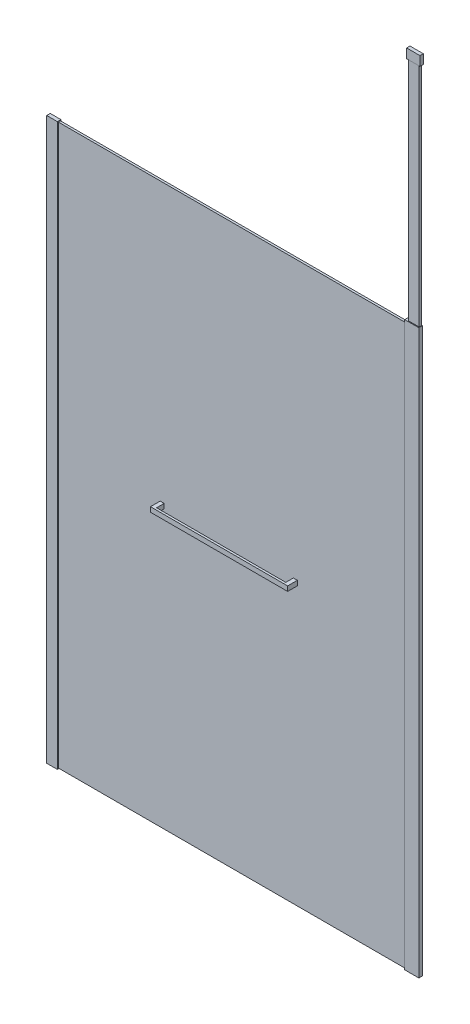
SolidWorks part; units mm, degrees
ref_plane "Płaszczyzna przednia" through (0, 0, 0) normal (0, 0, 1) x (1, 0, 0)
ref_plane "Płaszczyzna górna" through (0, 0, 0) normal (0, 1, 0) x (1, 0, 0)
ref_plane "Płaszczyzna prawa" through (0, 0, 0) normal (1, 0, 0) x (0, 0, -1)
sketch "Szkic1" plane through (0, 0, 0) normal (0, 1, 0) x (1, 0, 0)
  line L0 (0, 0) -> (0, 13.3)
  line L1 (0, 13.3) -> (40, 13.3)
  line L2 (40, 13.3) -> (40, 11.4)
  line L3 (40, 11.4) -> (6.5, 11.4)
  line L4 (6.5, 11.4) -> (6.5, 3.4)
  line L5 (6.5, 3.4) -> (40, 3.4)
  line L6 (40, 3.4) -> (40, 0)
  line L7 (40, 0) -> (0, 0)
  dimension "D1" = 40
  dimension "D2" = 13.3
  dimension "D3" = 33.5
  dimension "D4" = 1.9
  dimension "D5" = 8
extrude "Dodanie-wyciągnięcie1" add sketch "Szkic1" along normal blind 2100 from offset 3
sketch "Szkic2" plane through (0, 3, 0) normal (0, -1, 0) x (1, 0, 0)
  line L0 (6.5, -11.4) -> (40, -11.4) construction
  line L1 (6.5, -3.4) -> (1353.5, -3.4)
  line L2 (6.5, -3.4) -> (6.5, -11.4)
  line L3 (6.5, -11.4) -> (1353.5, -11.4)
  line L4 (1353.5, -3.4) -> (1353.5, -11.4)
  dimension "D1" = 1347
extrude "Dodanie-wyciągnięcie2" add sketch "Szkic2" against normal blind 2100 separate body
sketch "Szkic3" plane through (0, 3, 0) normal (0, -1, 0) x (1, 0, 0)
  line L0 (1343.4, -3.4) -> (1343.4, -0.4)
  line L1 (1353.5, -3.4) -> (6.5, -3.4) construction
  line L2 (1343.4, -0.4) -> (1396.4, -0.4)
  line L3 (1396.4, -0.4) -> (1396.4, -14.4)
  line L4 (1396.4, -14.4) -> (1343.4, -14.4)
  line L5 (1343.4, -14.4) -> (1343.4, -11.4)
  line L6 (1343.4, -11.4) -> (1353.5, -11.4)
  line L7 (1353.5, -11.4) -> (1353.5, -3.4)
  line L8 (1353.5, -3.4) -> (1343.4, -3.4)
  line L9 (6.5, -11.4) -> (1353.5, -11.4) construction
  line L10 (1353.5, -11.4) -> (1353.5, -3.4) construction
  dimension "D1" = 10.1
  dimension "D2" = 3
  dimension "D3" = 3
  dimension "D4" = 53
extrude "Dodanie-wyciągnięcie3" add sketch "Szkic3" against normal blind 2108 separate body
sketch "Szkic4" plane through (0, 2103, 0) normal (0, 1, 0) x (1, 0, 0)
  line L1 (0, 13.3) -> (40, 13.3)
  line L2 (0, 13.3) -> (0, 0)
  line L3 (0, 0) -> (40, 0)
  line L4 (40, 13.3) -> (40, 0)
extrude "Dodanie-wyciągnięcie4" add sketch "Szkic4" along normal blind 3
sketch "Szkic5" plane through (0, 2111, 0) normal (0, 1, 0) x (1, 0, 0)
  line L1 (1396.4, 14.4) -> (1343.4, 14.4)
  line L2 (1396.4, 14.4) -> (1396.4, 0.4)
  line L3 (1396.4, 0.4) -> (1343.4, 0.4)
  line L4 (1343.4, 14.4) -> (1343.4, 0.4)
extrude "Dodanie-wyciągnięcie5" add sketch "Szkic5" along normal blind 3
sketch "Szkic6" plane through (1343.4, 0, 0) normal (-1, 0, 0) x (0, 0, 1)
  line L0 (-11.4, 2111) -> (-3.4, 2111) construction
  line L1 (-3.35, 2111) -> (-11.45, 2111)
  line L2 (-3.35, 2111) -> (-3.35, 2103.2)
  line L3 (-3.35, 2103.2) -> (-11.45, 2103.2)
  line L4 (-11.45, 2111) -> (-11.45, 2103.2)
  point P6 (-7.4, 2111)
  dimension "D1" = 8.1
  dimension "D2" = 7.8
extrude "Dodanie-wyciągnięcie6" add sketch "Szkic6" against normal blind 15
sketch "Szkic7" plane through (0, 3, 0) normal (0, -1, 0) x (1, 0, 0)
  line L1 (1343.4, -0.4) -> (1396.4, -0.4)
  line L2 (1343.4, -0.4) -> (1343.4, -14.4)
  line L3 (1343.4, -14.4) -> (1396.4, -14.4)
  line L4 (1396.4, -0.4) -> (1396.4, -14.4)
extrude "Dodanie-wyciągnięcie7" add sketch "Szkic7" along normal blind 3
sketch "Szkic8" plane through (0, 3, 0) normal (0, -1, 0) x (1, 0, 0)
  line L1 (0, 0) -> (40, 0)
  line L2 (0, 0) -> (0, -13.3)
  line L3 (0, -13.3) -> (40, -13.3)
  line L4 (40, 0) -> (40, -13.3)
extrude "Dodanie-wyciągnięcie8" add sketch "Szkic8" along normal blind 3
sketch "Szkic9" plane through (0, 2114, 2099.6) normal (0, -1, 0) x (-1, 0, 0)
  line L1 (-1394.9, 2111) -> (-1354.9, 2111)
  line L2 (-1394.9, 2111) -> (-1394.9, 2103)
  line L3 (-1394.9, 2103) -> (-1354.9, 2103)
  line L4 (-1354.9, 2111) -> (-1354.9, 2103)
  line L7 (-1343.4, 2114) -> (-1396.4, 2114) construction
  line L8 (-1396.4, 2114) -> (-1396.4, 2100) construction
  dimension "D1" = 3
  dimension "D2" = 1.5
  dimension "D3" = 8
  dimension "D4" = 40
extrude "Dodanie-wyciągnięcie9" add sketch "Szkic9" against normal blind 883 separate body
sketch "Szkic10" plane through (0, 2997, 0) normal (0, 1, 0) x (-1, 0, 0)
  line L0 (-1374.9, -11.4) -> (-1374.9, -7.4) construction
  line L1 (-1399.9, -1.15) -> (-1349.9, -1.15)
  line L2 (-1399.9, -1.15) -> (-1399.9, -13.65)
  line L3 (-1399.9, -13.65) -> (-1349.9, -13.65)
  line L4 (-1349.9, -1.15) -> (-1349.9, -13.65)
  line L5 (-1399.9, -1.15) -> (-1349.9, -13.65) construction
  line L6 (-1399.9, -13.65) -> (-1349.9, -1.15) construction
  line L7 (-1354.9, -11.4) -> (-1394.9, -11.4) construction
  line L8 (-1374.9, -7.4) -> (-1394.9, -7.4) construction
  line L9 (-1394.9, -11.4) -> (-1394.9, -3.4) construction
  point P0 (-1374.9, -7.4)
  dimension "D1" = 12.5
  dimension "D2" = 50
extrude "Dodanie-wyciągnięcie10" add sketch "Szkic10" along normal blind 35 from offset 32
ref_plane "Płaszczyzna1" through (1374.9, 0, 0) normal (1, 0, 0) x (0, 0, -1)
sketch "Szkic12" plane through (0, 0, -3.4) normal (0, 0, 1) x (1, 0, 0)
  line L0 (680, 1409.7928) -> (680, 762.3594) construction
  line L1 (430, 1053) -> (930, 1053) construction
  line L2 (6.5, 2103) -> (6.5, 3) construction
  line L3 (1353.5, 2103) -> (1353.5, 3) construction
  line L5 (422.5, 1062) -> (437.5, 1062)
  line L6 (422.5, 1062) -> (422.5, 1044)
  line L7 (422.5, 1044) -> (437.5, 1044)
  line L8 (437.5, 1062) -> (437.5, 1044)
  line L9 (422.5, 1062) -> (437.5, 1044) construction
  line L10 (422.5, 1044) -> (437.5, 1062) construction
  line L11 (922.5, 1062) -> (937.5, 1062)
  line L12 (922.5, 1062) -> (922.5, 1044)
  line L13 (922.5, 1044) -> (937.5, 1044)
  line L14 (937.5, 1062) -> (937.5, 1044)
  line L15 (922.5, 1062) -> (937.5, 1044) construction
  line L16 (922.5, 1044) -> (937.5, 1062) construction
  dimension "D1" = 1053
  dimension "D2" = 500
  dimension "D3" = 15
  dimension "D4" = 18
extrude "Dodanie-wyciągnięcie11" add sketch "Szkic12" along normal blind 36.5 and the other way blind 18 separate body
sketch "Szkic13" plane through (437.5, 0, 0) normal (1, 0, 0) x (0, 0, -1)
  line L0 (21.4, 1044) -> (-33.1, 1044) construction
  line L1 (-33.1, 1062) -> (-25.1, 1062)
  line L2 (-33.1, 1062) -> (-33.1, 1044)
  line L3 (-33.1, 1044) -> (-25.1, 1044)
  line L4 (-25.1, 1062) -> (-25.1, 1044)
  dimension "D1" = 8
extrude "Dodanie-wyciągnięcie12" add sketch "Szkic13" along normal up to surface (485 mm away)
